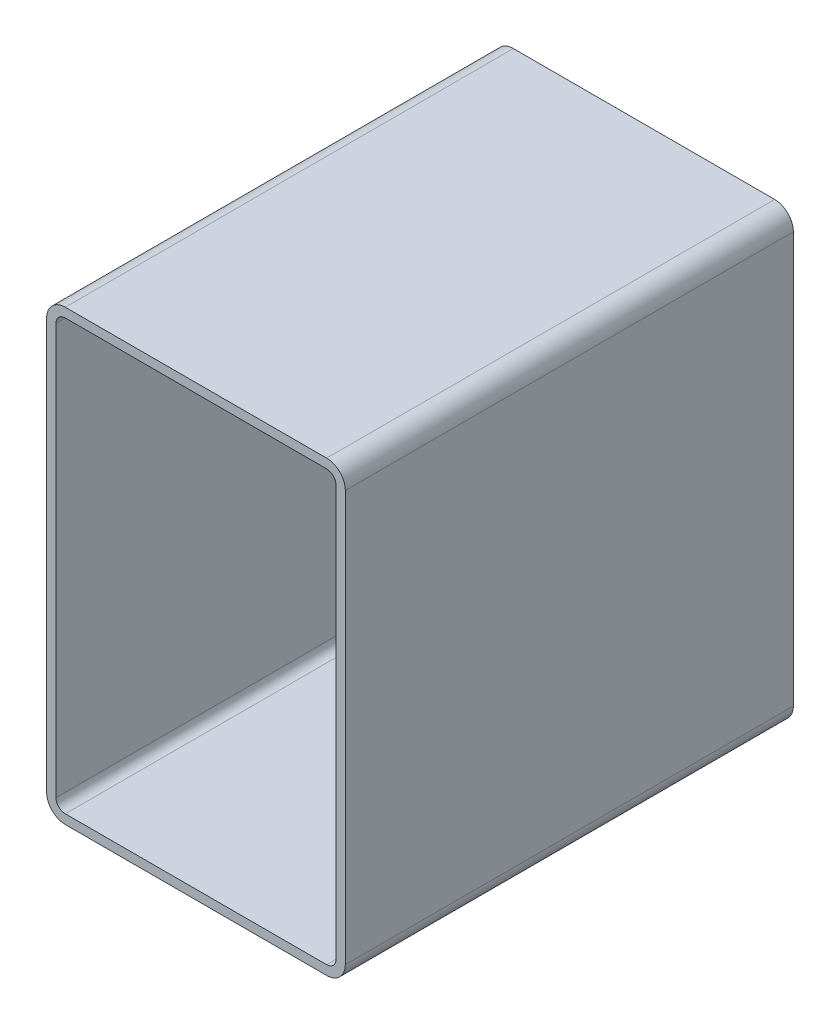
SolidWorks part; units mm, degrees
ref_plane "Front Plane" through (0, 0, 0) normal (0, 0, 1) x (1, 0, 0)
ref_plane "Top Plane" through (0, 0, 0) normal (0, 1, 0) x (1, 0, 0)
ref_plane "Right Plane" through (0, 0, 0) normal (1, 0, 0) x (0, 0, -1)
sketch "Sketch1" plane through (0, 0, 0) normal (0, 0, 1) x (1, 0, 0)
sketch_block_instance "HSS12x8x0.250-1"
sketch_block "HSS12x8x0.250"
extrude "Boss-Extrude1" add sketch "Sketch1" along normal blind 304.8
